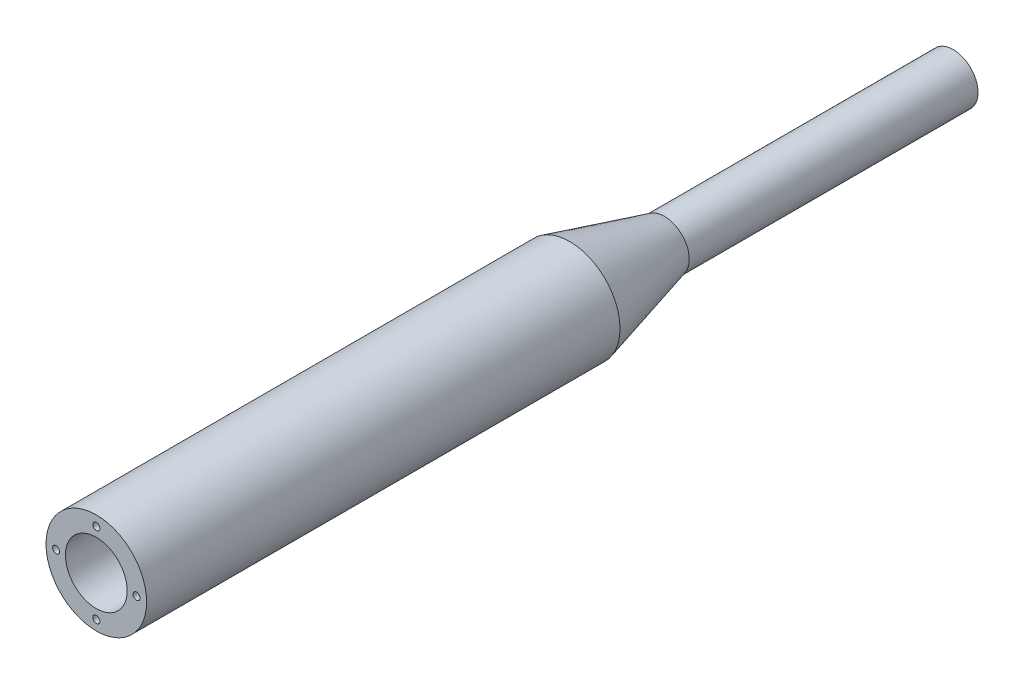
SolidWorks part; units mm, degrees
ref_plane "Front Plane" through (0, 0, 0) normal (0, 0, 1) x (1, 0, 0)
ref_plane "Top Plane" through (0, 0, 0) normal (0, 1, 0) x (1, 0, 0)
ref_plane "Right Plane" through (0, 0, 0) normal (1, 0, 0) x (0, 0, -1)
sketch "Sketch1" plane through (0, 0, 0) normal (0, 0, 1) x (1, 0, 0)
  circle A0 centre (0, 0) radius 26.9875
  dimension "D1" = 53.975
extrude "Boss-Extrude1" add sketch "Sketch1" along normal blind 254
sketch "Sketch2" plane through (0, 0, 0) normal (0, 0, -1) x (-1, 0, 0)
  circle A0 centre (0, 0) radius 6.35
  circle A1 centre (0, 0) radius 13.335
  dimension "D1" = 26.67
  dimension "D2" = 12.7
extrude "Boss-Extrude2" add sketch "Sketch2" along normal blind 205.74 separate body
sketch "Sketch4" plane through (0, 0, 0) normal (1, 0, 0) x (0, 0, -1)
  line L0 (0, 26.9875) -> (0, 13.335)
  line L1 (0, 26.9875) -> (50.8, 13.335)
  line L2 (205.74, 13.335) -> (0, 13.335) construction
  line L3 (0, 13.335) -> (50.8, 13.335)
  dimension "D1" = 50.8
ref_axis "Axis1" through (0, 0, -205.74) along (0, 0, 1)
revolve "Revolve1" add sketch "Sketch4" angle 360 about axis through (0, 0, -205.74) along (0, 0, 1)
hole_wizard "1 (1) Diameter Hole1" positions "Sketch6" profile "Sketch7" hole size "1" standard "ANSI Inch"
sketch "Sketch6" plane through (0, 0, 254) normal (0, 0, 1) x (1, 0, 0)
  point P0 (0, 0)
sketch "Sketch7" plane through (0, 0, 254) normal (1, 0, 0) x (0, -1, 0)
  line L0 (0, 0) -> (0, 263.5387)
  line L1 (0, 263.5387) -> (15.875, 254)
  line L2 (15.875, 254) -> (15.875, 0)
  line L5 (15.875, 0) -> (0, 0)
  line L10 (0, 263.5387) -> (-15.875, 254) construction
  line L11 (0, -6.35) -> (0, 107.95) construction
  dimension "Hole Dia." = 31.75
  dimension "Hole Depth" = 254
  dimension "Drill Angle" = 118
sketch "Sketch8" plane through (0, 0, 254) normal (0, 0, 1) x (1, 0, 0)
  circle A0 centre (0, 0) radius 16.5735
  dimension "D1" = 33.147
extrude "Cut-Extrude1" cut sketch "Sketch8" against normal blind 25.4
hole_wizard "#10-24 Tapped Hole1" positions "Sketch11" profile "Sketch9" tap size "#10-24" standard "ANSI Inch"
sketch "Sketch11" plane through (0, 0, 254) normal (0, 0, 1) x (1, 0, 0)
  circle A0 centre (0, 0) radius 21.59
  point P0 (0, 21.59)
  point P2 (-21.59, 0)
  point P4 (0, -21.59)
  point P6 (21.59, 0)
  dimension "D1" = 43.18
sketch "Sketch9" plane through (0, 21.59, 254) normal (1, 0, 0) x (0, -1, 0)
  line L0 (0, 0) -> (0, 26.5408)
  line L1 (0, 26.5408) -> (1.8986, 25.4)
  line L2 (1.8986, 25.4) -> (1.8986, 0)
  line L5 (1.8986, 0) -> (0, 0)
  line L10 (0, 26.5408) -> (-1.8987, 25.4) construction
  line L11 (0, -6.35) -> (0, 107.95) construction
  dimension "Tap Drill Dia." = 3.7973
  dimension "Tap Drill Depth" = 25.4
  dimension "Drill Angle" = 118
